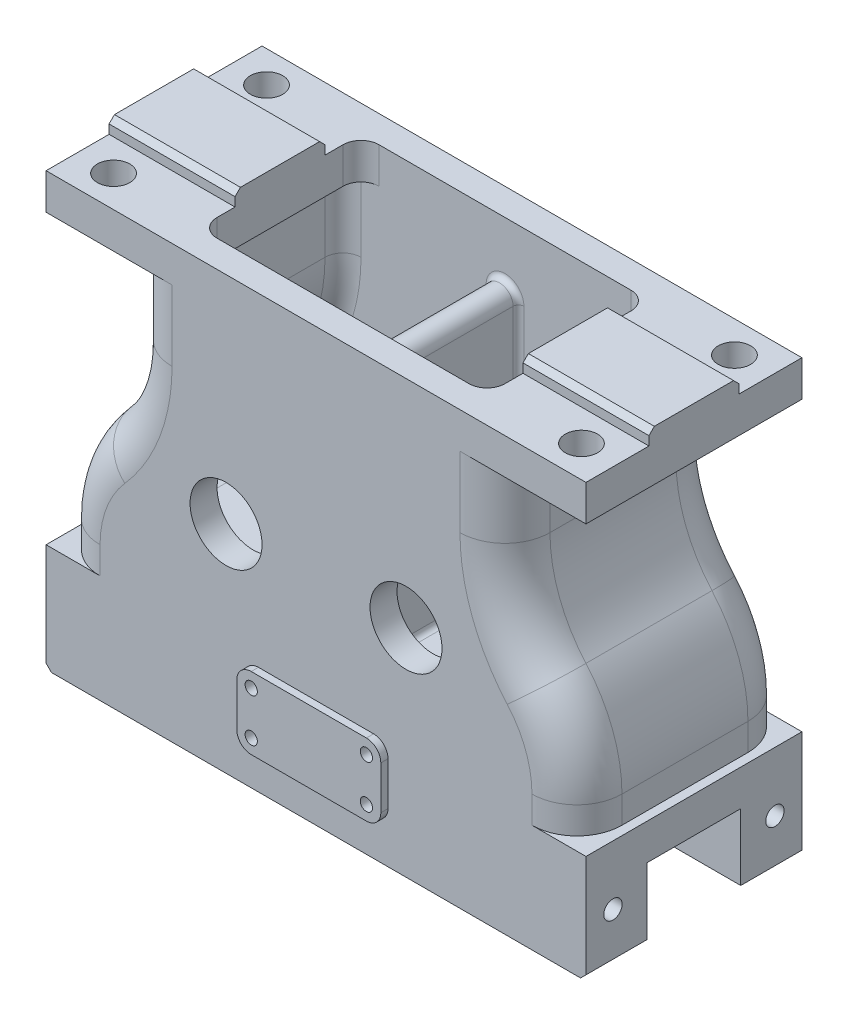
SolidWorks part; units mm, degrees
ref_plane "前视基准面" through (0, 0, 0) normal (0, 0, 1) x (1, 0, 0)
ref_plane "上视基准面" through (0, 0, 0) normal (0, 1, 0) x (1, 0, 0)
ref_plane "右视基准面" through (0, 0, 0) normal (1, 0, 0) x (0, 0, -1)
sketch "草图1" plane through (0, 0, 0) normal (0, 0, 1) x (1, 0, 0)
  line L0 (-145, 15) -> (-145, 0)
  line L1 (-145, 0) -> (145, 0)
  line L2 (145, 0) -> (145, 15)
  line L3 (-105, 120.8301) -> (-105, 160)
  line L4 (-105, 160) -> (105, 160)
  line L5 (0, -94.5942) -> (0, 94.5942) construction
  line L6 (105, 120.8301) -> (105, 160)
  line L7 (145, 15) -> (145, 0)
  arc A0 (-145, 15) -> (-125, 67.915) centre (-65, 15) cw
  arc A1 (-125, 67.915) -> (-105, 120.8301) centre (-185, 120.8301) ccw
  arc A2 (125, 67.915) -> (105, 120.8301) centre (185, 120.8301) cw
  arc A3 (145, 15) -> (125, 67.915) centre (65, 15) ccw
  point P3 (0, 0)
  point P16 (0, 160)
  dimension "D3" = 80
  dimension "D4" = 80
  dimension "D1" = 290
  dimension "D2" = 15
  dimension "D5" = 210
  dimension "D6" = 160
extrude "凸台-拉伸1" add sketch "草图1" along normal mid plane 120 contours L2 A3 A2 L6 L4 L3 A1 A0 L0 L1
shell "抽壳1" thickness 15
sketch "草图2" plane through (0, 0, -45) normal (0, 0, 1) x (1, 0, 0)
  line L0 (-130, 10) -> (130, 10) construction
  line L2 (-7.5, 142.5) -> (-7.5, 10)
  line L3 (-7.5, 10) -> (7.5, 10)
  line L4 (7.5, 142.5) -> (7.5, 10)
  arc A0 (-7.5, 142.5) -> (7.5, 142.5) centre (0, 142.5) cw
  point P6 (0, 10)
  point P11 (0, 150)
  dimension "D1" = 15
  dimension "D2" = 140
extrude "凸台-拉伸2" add sketch "草图2" along normal up to surface (90 mm away)
fillet "圆角1" radius 25 16 edges at (145, 7.5, 60) (139.8331, 43.2843, 60) (105, 140.415, 60) (145, 7.5, -60) (139.8331, 43.2843, -60) (105, 140.415, -60) (-145, 7.5, -60) (-105, 140.415, -60) (-110.1669, 92.5458, -60) (-145, 7.5, 60) (-139.8331, 43.2843, 60) (-110.1669, 92.5458, 60) (110.1669, 92.5458, 60) (110.1669, 92.5458, -60) (-139.8331, 43.2843, -60) (-105, 140.415, 60)
fillet "圆角2" radius 10 15 edges at (130, 12.5, 45) (125.8019, 37.981, 45) (96.1356, 87.2425, 45) (130, 12.5, -45) (125.8019, 37.981, -45) (90, 140.415, -45) (-125.8019, 37.981, 45) (-90, 140.415, 45) (-125.8019, 37.981, -45) (-90, 140.415, -45) (-130, 10, 0) (90, 140.415, 45) (96.1356, 87.2425, -45) (-96.1356, 87.2425, 45) (-96.1356, 87.2425, -45)
fillet "圆角3" radius 10 9 edges at (-124.7836, 11.3463, 43.72) (-124.7836, 11.3463, -43.72) (63.75, 10, 45) (127.0711, 10, 42.0711) (130, 10, 0) (127.0711, 10, -42.0711) (-63.6361, 10, 45) (-63.6361, 10, -45) (63.75, 10, -45)
fillet "圆角4" radius 3 12 edges at (7.5, 12.9289, -42.0711) (7.5, 10, 0) (7.5, 12.9289, 42.0711) (7.5, 81.25, 45) (0, 150, 45) (-7.5, 81.25, 45) (-7.5, 12.9289, 42.0711) (-7.5, 10, 0) (-7.5, 12.9289, -42.0711) (-7.5, 81.25, -45) (0, 150, -45) (7.5, 81.25, -45)
sketch "草图3" plane through (0, 160, 0) normal (0, 1, 0) x (1, 0, 0)
  line L0 (-80, -45) -> (80, -45) construction
  line L1 (-150, 60) -> (150, 60)
  line L2 (-150, 60) -> (-150, -60)
  line L3 (-150, -60) -> (150, -60)
  line L4 (150, 60) -> (150, -60)
  line L5 (-70, 45) -> (70, 45)
  line L6 (-80, 35) -> (-80, -35)
  line L7 (-70, -45) -> (70, -45)
  line L8 (80, 35) -> (80, -35)
  line L9 (-80, -60) -> (80, -60) construction
  arc A0 (70, 45) -> (80, 35) centre (70, 35) cw
  arc A1 (70, -45) -> (80, -35) centre (70, -35) ccw
  arc A2 (-80, -35) -> (-70, -45) centre (-70, -35) ccw
  arc A3 (-70, 45) -> (-80, 35) centre (-70, 35) ccw
  point P4 (0, -60)
  point P6 (-150, 0)
  point P11 (0, -45)
  point P12 (-80, 0)
  point P17 (80, -45)
  point P22 (80, -45)
  point P25 (-80, -45)
  dimension "D3" = 10
  dimension "D1" = 160
  dimension "D2" = 300
extrude "凸台-拉伸3" add sketch "草图3" along normal blind 20
sketch "草图4" plane through (0, 180, 0) normal (0, 1, 0) x (1, 0, 0)
  line L0 (-80, 35) -> (-80, -35) construction
  line L1 (-150, 25) -> (-80, 25)
  line L2 (-150, 25) -> (-150, -25)
  line L3 (-150, -25) -> (-80, -25)
  line L4 (-80, 25) -> (-80, -25)
  line L5 (80, 25) -> (150, 25)
  line L6 (80, 25) -> (80, -25)
  line L7 (80, -25) -> (150, -25)
  line L8 (150, 25) -> (150, -25)
  line L9 (-150, 60) -> (-150, -60) construction
  line L10 (150, -60) -> (150, 60) construction
  line L11 (80, -35) -> (80, 35) construction
  point P12 (-150, 0)
  dimension "D1" = 50
extrude "凸台-拉伸4" add sketch "草图4" along normal blind 8
chamfer "倒角1" distance 3 angle 45 4 edges at (115, 188, -25) (115, 188, 25) (-115, 188, 25) (-115, 188, -25)
sketch "草图5" plane through (0, 180, 0) normal (0, 1, 0) x (1, 0, 0)
  line L0 (-103.4, 0) -> (103.4, 0) construction
  line L1 (0, -66) -> (0, 66) construction
  circle A0 centre (130, 42.5) radius 9
  circle A2 centre (130, -42.5) radius 9
  circle A3 centre (-130, -42.5) radius 9
  circle A4 centre (-130, 42.5) radius 9
  point P5 (34.9957, -26.4101)
  dimension "D3" = 18
  dimension "D1" = 42.5
  dimension "D2" = 130
extrude "切除-拉伸1" cut sketch "草图5" against normal up to next
sketch "草图6" plane through (0, 160, 0) normal (0, -1, 0) x (1, 0, 0)
  line L0 (103.4, 0) -> (-103.4, 0) construction
  line L1 (0, -66) -> (0, 66) construction
  circle A0 centre (130, 42.5) radius 16
  circle A1 centre (130, 42.5) radius 9 construction
  circle A2 centre (130, -42.5) radius 16
  circle A3 centre (-130, -42.5) radius 16
  circle A4 centre (-130, 42.5) radius 16
  point P2 (0, 0)
  dimension "D1" = 32
extrude "切除-拉伸2" cut sketch "草图6" against normal blind 3
sketch "草图7" plane through (0, 0, 60) normal (0, 0, 1) x (1, 0, 0)
  line L1 (-150, 180) -> (150, 180) construction
  line L2 (0, -66) -> (0, 66) construction
  circle A0 centre (50, 60) radius 20
  circle A1 centre (-50, 60) radius 20
  point P5 (66.8817, 180)
  dimension "D3" = 40
  dimension "D1" = 50
  dimension "D2" = 120
extrude "切除-拉伸3" cut sketch "草图7" against normal up to surface (120 mm away)
sketch "草图8" plane through (0, 0, 0) normal (1, 0, 0) x (0, 0, -1)
  line L0 (60, -60) -> (60, 0)
  line L1 (60, 0) -> (-60, 0)
  line L2 (-60, 0) -> (-60, -60)
  line L3 (-60, -60) -> (-26, -60)
  line L4 (-26, -60) -> (-26, -20)
  line L6 (26, -20) -> (26, -60)
  line L7 (26, -60) -> (60, -60)
  line L8 (-35, 0) -> (35, 0) construction
  line L10 (-60, 80) -> (-60, 40) construction
  line L11 (60, 40) -> (60, 80) construction
  line L12 (26, -20) -> (32.5, -20)
  line L13 (32.5, -20) -> (32.5, 0)
  line L14 (32.5, 0) -> (-32.5, 0)
  line L15 (-32.5, 0) -> (-32.5, -20)
  line L16 (-32.5, -20) -> (-26, -20)
  line L17 (26, -20) -> (-26, -20) construction
  point P17 (0, -20)
  point P20 (0, 0)
  dimension "D1" = 65
  dimension "D2" = 60
  dimension "D3" = 52
  dimension "D4" = 20
extrude "凸台-拉伸5" add sketch "草图8" along normal mid plane 300 contours L16 L15 L1 L2 L3 L4 | L13 L12 L6 L7 L0 L1 | L17 L12 L13 L1 L15 L16
chamfer "倒角2" distance 3 angle 45 6 edges at (150, -60, 43) (0, -60, 26) (-150, -60, 43) (150, -60, -43) (-150, -60, -43) (0, -60, -26)
sketch "草图9" plane through (0, 0, 60) normal (0, 0, 1) x (1, 0, 0)
  line L0 (147, -60) -> (-147, -60) construction
  line L1 (-32, 0) -> (32, 0)
  line L2 (-40, -8) -> (-40, -32)
  line L3 (-32, -40) -> (32, -40)
  line L4 (40, -8) -> (40, -32)
  arc A0 (-40, -32) -> (-32, -40) centre (-32, -32) ccw
  arc A1 (32, -40) -> (40, -32) centre (32, -32) ccw
  arc A2 (32, 0) -> (40, -8) centre (32, -8) cw
  arc A3 (-32, 0) -> (-40, -8) centre (-32, -8) ccw
  point P4 (40, -20)
  point P7 (0, 0)
  point P13 (40, -40)
  point P16 (40, 0)
  point P19 (-40, 0)
  dimension "D4" = 8
  dimension "D1" = 80
  dimension "D2" = 40
  dimension "D3" = 40
extrude "凸台-拉伸6" add sketch "草图9" along normal blind 4
sketch "草图10" plane through (150, 0, 0) normal (1, 0, 0) x (0, 0, -1)
  line L1 (-29, -60) -> (-60, -60) construction
  circle A0 centre (-45, -33) radius 6
  point P6 (-102.2241, 46.5839)
  dimension "D3" = 12
  dimension "D1" = 27
  dimension "D2" = 45
hole_wizard "M12 螺纹孔1" positions "3D草图1" profile "草图11" tap size "M12" standard "ISO"
sketch3d "3D草图1"
  point P0 (150, -33, 45)
sketch "草图11" plane through (150, -33, 45) normal (0, 1, 0) x (0, 0, -1)
  line L0 (0, 0) -> (0, 32.3144)
  line L1 (0, 32.3144) -> (5.1, 29.25)
  line L2 (5.1, 29.25) -> (5.1, 0)
  line L5 (5.1, 0) -> (0, 0)
  line L10 (0, 32.3144) -> (-5.1, 29.25) construction
  line L11 (0, -6.35) -> (0, 107.95) construction
  dimension "螺纹孔钻头直径" = 10.2
  dimension "螺纹孔钻头深度" = 29.25
  dimension "导头角度" = 118
mirror "镜向1" about plane through (0, 0, 0) normal (0, 0, 1) of "M12 螺纹孔1"
mirror "镜向2" about plane through (0, 0, 0) normal (1, 0, 0) of "镜向1", "M12 螺纹孔1"
sketch "草图12" plane through (0, 0, 64) normal (0, 0, 1) x (1, 0, 0)
  line L0 (0, -68.2) -> (0, 68.2) construction
  line L1 (-32, -8) -> (-32, -32) construction
  line L2 (-40, -8) -> (-40, -32) construction
  circle A0 centre (-32, -8) radius 4
  circle A1 centre (32, -8) radius 4
  circle A2 centre (-32, -32) radius 4
  circle A3 centre (32, -32) radius 4
  point P10 (-32, -20)
  point P13 (-40, -20)
  point P14 (0, 0)
  dimension "D3" = 8
  dimension "D1" = 64
  dimension "D2" = 24
hole_wizard "M8 螺纹孔2" positions "3D草图2" profile "草图13" tap size "M8" standard "ISO"
sketch3d "3D草图2"
  point P0 (-32, -8, 64)
  point P3 (-32, -32, 64)
  point P6 (32, -32, 64)
  point P9 (32, -8, 64)
sketch "草图13" plane through (-32, -8, 64) normal (1, 0, 0) x (0, -1, 0)
  line L0 (0, 0) -> (0, 22.0429)
  line L1 (0, 22.0429) -> (3.4, 20)
  line L2 (3.4, 20) -> (3.4, 0)
  line L5 (3.4, 0) -> (0, 0)
  line L10 (0, 22.0429) -> (-3.4, 20) construction
  line L11 (0, -6.35) -> (0, 107.95) construction
  dimension "螺纹孔钻头直径" = 6.8
  dimension "螺纹孔钻头深度" = 20
  dimension "导头角度" = 118
